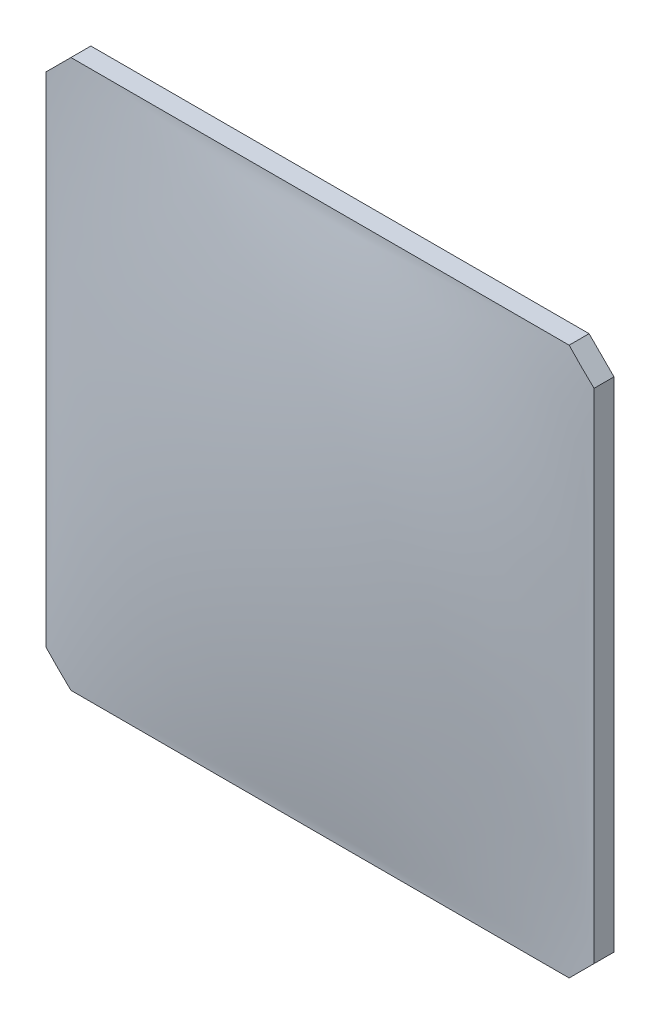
SolidWorks part; units mm, degrees
ref_plane "Face" through (0, 0, 0) normal (0, 0, 1) x (1, 0, 0)
ref_plane "Dessus" through (0, 0, 0) normal (0, 1, 0) x (1, 0, 0)
ref_plane "Droite" through (0, 0, 0) normal (1, 0, 0) x (0, 0, -1)
sketch "Esquisse1" plane through (0, 0, 0) normal (0, 0, 1) x (1, 0, 0)
  line L1 (0, 0) -> (220, 0)
  line L2 (0, 0) -> (0, -220)
  line L3 (0, -220) -> (220, -220)
  line L4 (220, 0) -> (220, -220)
  dimension "D1" = 220
  dimension "D2" = 220
extrude "Base-Extrusion" add sketch "Esquisse1" along normal blind 8
dome "Dôme1" faces to dome 1 distance 10 parameters "D1"=10
chamfer "Chanfrein1" distance 10 angle 45
shell "Coque1" thickness 10
